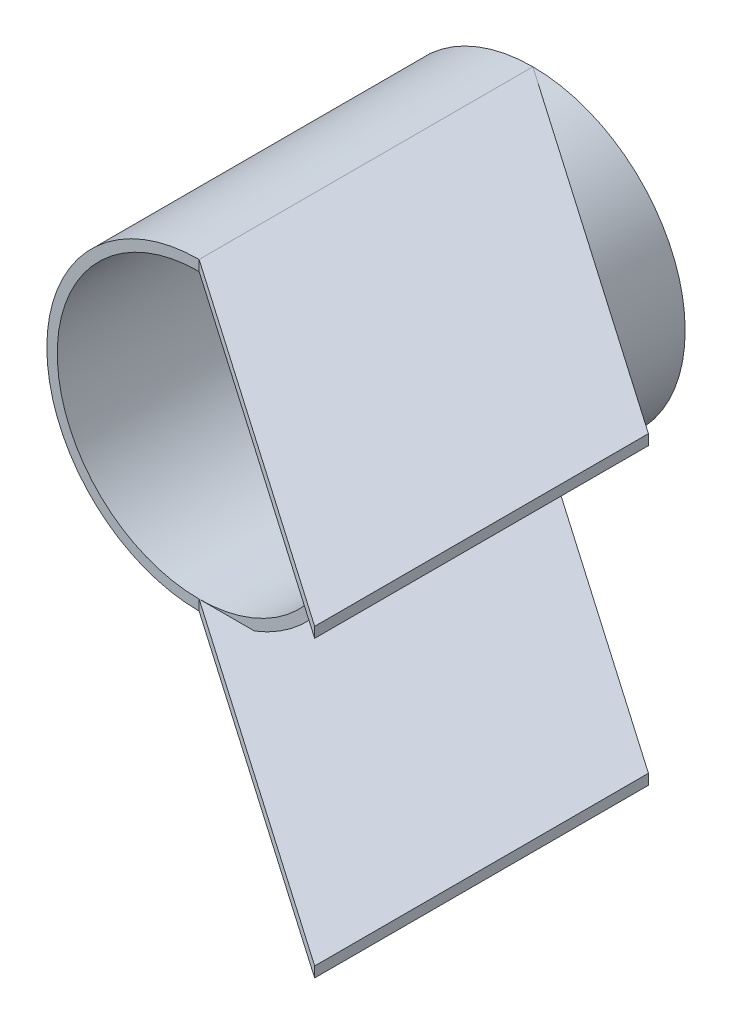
SolidWorks part; units mm, degrees
ref_plane "Front Plane" through (0, 0, 0) normal (0, 0, 1) x (1, 0, 0)
ref_plane "Top Plane" through (0, 0, 0) normal (0, 1, 0) x (1, 0, 0)
ref_plane "Right Plane" through (0, 0, 0) normal (1, 0, 0) x (0, 0, -1)
sketch "Sketch1" plane through (0, 0, 0) normal (0, 0, 1) x (1, 0, 0)
  circle A0 centre (0, 0) radius 43.18
  circle A1 centre (0, 0) radius 46.355
  dimension "D1" = 86.36
  dimension "D2" = 92.71
extrude "Boss-Extrude1" add sketch "Sketch1" along normal blind 101.6
ref_plane "Plane1" through (0, 43.18, 0) normal (0, 1, 0) x (1, 0, 0)
ref_plane "Plane2" through (0, -43.18, 0) normal (0, 1, 0) x (1, 0, 0)
sketch "Sketch3" plane through (0, 43.18, 0) normal (0, 1, 0) x (1, 0, 0)
  line L0 (0, 0) -> (0, -101.6)
  line L1 (-46.355, -101.6) -> (46.355, -101.6) construction
  line L2 (0, 0) -> (165.1, -114.3)
  line L3 (0, -101.6) -> (165.1, -215.9)
  line L4 (165.1, -114.3) -> (165.1, -215.9)
  dimension "D1" = 165.1
  dimension "D2" = 114.3
extrude "Boss-Extrude2" add sketch "Sketch3" along normal blind 3.175
mirror "Mirror1" about plane through (0, 0, 0) normal (0, 1, 0) of "Boss-Extrude2"
sketch "Sketch4" plane through (0, 46.355, 0) normal (0, 1, 0) x (1, 0, 0)
  line L0 (165.1, -114.3) -> (161.925, -112.1019)
  line L1 (165.1, -114.3) -> (0, 0) construction
  line L2 (161.925, -112.1019) -> (161.925, -213.7019)
  line L3 (0, -101.6) -> (165.1, -215.9) construction
  line L4 (161.925, -213.7019) -> (165.1, -215.9)
  line L5 (165.1, -215.9) -> (165.1, -114.3)
  dimension "D1" = 3.175
extrude "Boss-Extrude3" add sketch "Sketch4" along normal blind 38.1
sketch "Sketch5" plane through (165.1, 0, 0) normal (1, 0, 0) x (0, 0, -1)
  line L0 (-215.9, 40.7126) -> (-196.85, 84.455)
  line L2 (-215.9, 84.455) -> (-114.3, 84.455) construction
  line L3 (-112.1287, 46.4419) -> (-139.7, 84.455)
  line L4 (-139.7, 84.455) -> (-112.1287, 84.455)
  line L5 (-112.1287, 84.455) -> (-112.1287, 46.4419)
  line L6 (-215.9, 40.7126) -> (-215.9, 84.455)
  line L7 (-215.9, 84.455) -> (-196.85, 84.455)
  line L8 (-215.9, 84.455) -> (-215.9, 43.18) construction
  dimension "D1" = 57.15
  dimension "D2" = 19.05
extrude "mt flange" cut sketch "Sketch5" against normal through all
mirror "Mirror2" about plane through (0, 0, 0) normal (0, 1, 0) of "Boss-Extrude3"
mirror "Mirror3" about plane through (0, 0, 0) normal (0, 1, 0) of "mt flange"
sketch "Sketch6" plane through (0, 43.18, 0) normal (0, 1, 0) x (1, 0, 0)
  line L0 (165.1, -196.85) -> (165.1, -139.7) construction
  line L1 (114.3, -225.4491) -> (197.3809, -225.4491)
  line L2 (114.3, -225.4491) -> (114.3, -62.9575)
  line L3 (114.3, -62.9575) -> (197.3809, -62.9575)
  line L4 (197.3809, -225.4491) -> (197.3809, -62.9575)
  dimension "D1" = 50.8
extrude "cut off flanges" cut sketch "Sketch6" against normal through all and the other way through all
